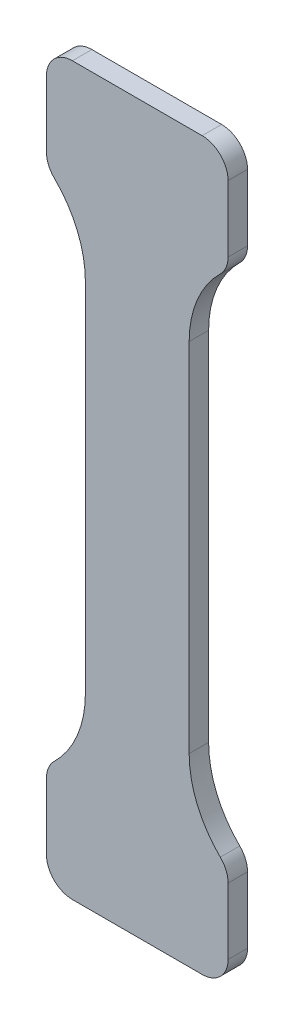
SolidWorks part; units mm, degrees
ref_plane "Plan de face" through (0, 0, 0) normal (0, 0, 1) x (1, 0, 0)
ref_plane "Plan de dessus" through (0, 0, 0) normal (0, 1, 0) x (1, 0, 0)
ref_plane "Plan de droite" through (0, 0, 0) normal (1, 0, 0) x (0, 0, -1)
sketch "Esquisse1" plane through (0, 0, 0) normal (0, 0, 1) x (1, 0, 0)
  line L0 (-18.0088, 24) -> (35.5714, 24) construction
  line L1 (4, 20) -> (7, 20)
  line L2 (-4, 20) -> (-4, -20)
  line L3 (4, -20) -> (7, -20)
  line L4 (4, 20) -> (4, -20)
  line L5 (-7, -20) -> (-4, -20)
  line L6 (-7, -20) -> (-7, -28)
  line L7 (-7, -28) -> (7, -28)
  line L8 (7, -20) -> (7, -28)
  line L9 (-7, 28) -> (7, 28)
  line L10 (-7, 28) -> (-7, 20)
  line L11 (-7, 20) -> (-4, 20)
  line L12 (7, 28) -> (7, 20)
  line L13 (0, 28) -> (0, -28) construction
  dimension "D1" = 40
  dimension "D2" = 8
  dimension "D3" = 8
  dimension "D4" = 14
extrude "Boss.-Extru.1" add sketch "Esquisse1" along normal blind 1.5
fillet "Congé1" radius 8 4 edges at (-4, 20, 0.75) (4, 20, 0.75) (4, -20, 0.75) (-4, -20, 0.75)
fillet "Congé2" radius 2 8 edges at (-7, 28, 0.75) (-7, 20, 0.75) (-7, -20, 0.75) (-7, -28, 0.75) (7, -28, 0.75) (7, -20, 0.75) (7, 20, 0.75) (7, 28, 0.75)
sketch "Esquisse2" plane through (0, 0, 0) normal (0, 0, 1) x (1, 0, 0)
  line L0 (0, 28) -> (0, -28) construction
  line L1 (5, 28) -> (-5, 28) construction
  line L2 (-5, -28) -> (5, -28) construction
  line L3 (-7, 23.4482) -> (7, 23.4482) construction
  line L4 (-7, 26) -> (-7, 20.8964) construction
  line L5 (7, 20.8964) -> (7, 26) construction
  line L6 (-7, -23.4482) -> (7, -23.4482) construction
  line L7 (-7, -20.8964) -> (-7, -26) construction
  line L8 (7, -26) -> (7, -20.8964) construction
  point P18 (0, 23.4482)
  point P19 (0, -23.4482)
